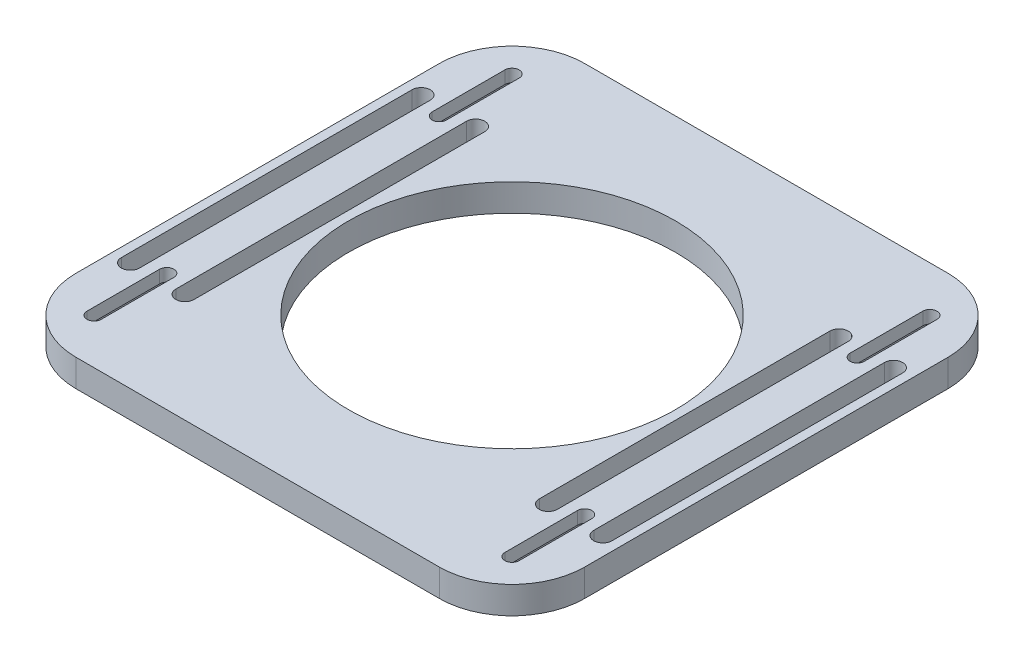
SolidWorks part; units mm, degrees
ref_plane "Front Plane" through (0, 0, 0) normal (0, 0, 1) x (1, 0, 0)
ref_plane "Top Plane" through (0, 0, 0) normal (0, 1, 0) x (1, 0, 0)
ref_plane "Right Plane" through (0, 0, 0) normal (1, 0, 0) x (0, 0, -1)
sketch "Sketch1" plane through (0, 0, 0) normal (0, 1, 0) x (1, 0, 0)
  line L1 (-88.9, 88.9) -> (88.9, 88.9)
  line L2 (-88.9, 88.9) -> (-88.9, -88.9)
  line L3 (-88.9, -88.9) -> (88.9, -88.9)
  line L4 (88.9, 88.9) -> (88.9, -88.9)
  line L5 (-88.9, 88.9) -> (88.9, -88.9) construction
  line L6 (-88.9, -88.9) -> (88.9, 88.9) construction
  circle A0 centre (0, 0) radius 57.15
  point P0 (0, 0)
  dimension "D3" = 114.3
  dimension "D1" = 177.8
  dimension "D2" = 177.8
extrude "Boss-Extrude1" add sketch "Sketch1" along normal blind 9.525
fillet "Fillet1" radius 25.4 4 edges at (-88.9, 4.7625, -88.9) (88.9, 4.7625, -88.9) (88.9, 4.7625, 88.9) (-88.9, 4.7625, 88.9)
sketch "Sketch2" plane through (0, 9.525, 0) normal (0, 1, 0) x (1, 0, 0)
  line L0 (0, -107.4058) -> (0, 115.9567) construction
  line L1 (-110.9939, 0) -> (128.1398, 0) construction
  line L2 (73.025, -103.7714) -> (73.025, 98.4828) construction
  line L3 (63.5, -103.7714) -> (63.5, 98.4828) construction
  line L4 (82.55, 98.4828) -> (82.55, -103.7714) construction
  line L5 (82.55, 50.8) -> (82.55, -50.8) construction
  line L6 (85.725, 50.8) -> (85.725, -50.8)
  line L7 (79.375, 50.8) -> (79.375, -50.8)
  line L8 (63.5, 50.8) -> (63.5, -50.8) construction
  line L9 (60.325, 50.8) -> (60.325, -50.8)
  line L10 (66.675, 50.8) -> (66.675, -50.8)
  line L11 (-82.55, 50.8) -> (-82.55, -50.8) construction
  line L12 (-85.725, 50.8) -> (-85.725, -50.8)
  line L13 (-79.375, 50.8) -> (-79.375, -50.8)
  line L14 (-63.5, 50.8) -> (-63.5, -50.8) construction
  line L15 (-60.325, 50.8) -> (-60.325, -50.8)
  line L16 (-66.675, 50.8) -> (-66.675, -50.8)
  arc A0 (85.725, 50.8) -> (79.375, 50.8) centre (82.55, 50.8) ccw
  arc A1 (79.375, -50.8) -> (85.725, -50.8) centre (82.55, -50.8) ccw
  arc A2 (60.325, 50.8) -> (66.675, 50.8) centre (63.5, 50.8) cw
  arc A3 (66.675, -50.8) -> (60.325, -50.8) centre (63.5, -50.8) cw
  arc A4 (-85.725, 50.8) -> (-79.375, 50.8) centre (-82.55, 50.8) cw
  arc A5 (-79.375, -50.8) -> (-85.725, -50.8) centre (-82.55, -50.8) cw
  arc A6 (-60.325, 50.8) -> (-66.675, 50.8) centre (-63.5, 50.8) ccw
  arc A7 (-66.675, -50.8) -> (-60.325, -50.8) centre (-63.5, -50.8) ccw
  point P13 (82.55, 0)
  point P20 (63.5, 0)
  point P27 (-82.55, 0)
  point P34 (-63.5, 0)
  dimension "D4" = 101.6
  dimension "D1" = 9.525
  dimension "D2" = 9.525
  dimension "D3" = 73.025
extrude "Cut-Extrude1" cut sketch "Sketch2" against normal blind 6.35
sketch "Sketch3" plane through (0, 9.525, 0) normal (0, 1, 0) x (1, 0, 0)
  line L0 (73.025, -112.4398) -> (73.025, 109.7359) construction
  line L1 (123.9264, 0) -> (-104.5674, 0) construction
  line L2 (73.025, -73.025) -> (73.025, -47.625) construction
  line L3 (70.5358, -73.025) -> (70.5358, -47.625)
  line L4 (75.5142, -73.025) -> (75.5142, -47.625)
  line L5 (73.025, 73.025) -> (73.025, 47.625) construction
  line L6 (70.5358, 73.025) -> (70.5358, 47.625)
  line L7 (75.5142, 73.025) -> (75.5142, 47.625)
  line L8 (0, 0) -> (0, 95.2721) construction
  line L9 (-73.025, -73.025) -> (-73.025, -47.625) construction
  line L10 (-70.5358, -73.025) -> (-70.5358, -47.625)
  line L11 (-75.5142, -73.025) -> (-75.5142, -47.625)
  line L12 (-73.025, 73.025) -> (-73.025, 47.625) construction
  line L13 (-70.5358, 73.025) -> (-70.5358, 47.625)
  line L14 (-75.5142, 73.025) -> (-75.5142, 47.625)
  circle A0 centre (0, 0) radius 57.15 construction
  arc A2 (70.5358, -73.025) -> (75.5142, -73.025) centre (73.025, -73.025) ccw
  arc A3 (75.5142, -47.625) -> (70.5358, -47.625) centre (73.025, -47.625) ccw
  arc A4 (70.5358, 73.025) -> (75.5142, 73.025) centre (73.025, 73.025) cw
  arc A5 (75.5142, 47.625) -> (70.5358, 47.625) centre (73.025, 47.625) cw
  arc A6 (-70.5358, -73.025) -> (-75.5142, -73.025) centre (-73.025, -73.025) cw
  arc A7 (-75.5142, -47.625) -> (-70.5358, -47.625) centre (-73.025, -47.625) cw
  arc A8 (-70.5358, 73.025) -> (-75.5142, 73.025) centre (-73.025, 73.025) ccw
  arc A9 (-75.5142, 47.625) -> (-70.5358, 47.625) centre (-73.025, 47.625) ccw
  point P9 (73.025, -60.325)
  point P16 (73.025, 60.325)
  point P26 (-73.025, -60.325)
  point P33 (-73.025, 60.325)
  dimension "D2" = 60.325
  dimension "D3" = 25.4
  dimension "D1" = 73.025
extrude "Cut-Extrude2" cut sketch "Sketch3" against normal through all
sketch "Sketch4" plane through (0, 0, 0) normal (0, -1, 0) x (1, 0, 0)
  line L0 (73.025, 73.025) -> (73.025, 47.625) construction
  line L1 (77.47, 73.025) -> (77.47, 47.625)
  line L2 (68.58, 73.025) -> (68.58, 47.625)
  line L3 (0, 0) -> (0, 117.4438) construction
  line L4 (0, 0) -> (99.4656, 0) construction
  line L5 (-73.025, 73.025) -> (-73.025, 47.625) construction
  line L6 (-77.47, 73.025) -> (-77.47, 47.625)
  line L7 (-68.58, 73.025) -> (-68.58, 47.625)
  line L8 (73.025, -73.025) -> (73.025, -47.625) construction
  line L9 (77.47, -73.025) -> (77.47, -47.625)
  line L10 (68.58, -73.025) -> (68.58, -47.625)
  line L11 (-73.025, -73.025) -> (-73.025, -47.625) construction
  line L12 (-77.47, -73.025) -> (-77.47, -47.625)
  line L13 (-68.58, -73.025) -> (-68.58, -47.625)
  arc A0 (77.47, 73.025) -> (68.58, 73.025) centre (73.025, 73.025) ccw
  arc A1 (68.58, 47.625) -> (77.47, 47.625) centre (73.025, 47.625) ccw
  arc A2 (-77.47, 73.025) -> (-68.58, 73.025) centre (-73.025, 73.025) cw
  arc A3 (-68.58, 47.625) -> (-77.47, 47.625) centre (-73.025, 47.625) cw
  arc A4 (77.47, -73.025) -> (68.58, -73.025) centre (73.025, -73.025) cw
  arc A5 (68.58, -47.625) -> (77.47, -47.625) centre (73.025, -47.625) cw
  arc A6 (-77.47, -73.025) -> (-68.58, -73.025) centre (-73.025, -73.025) ccw
  arc A7 (-68.58, -47.625) -> (-77.47, -47.625) centre (-73.025, -47.625) ccw
  point P4 (73.025, 60.325)
  point P15 (-73.025, 60.325)
  point P22 (73.025, -60.325)
  point P29 (-73.025, -60.325)
extrude "Cut-Extrude3" cut sketch "Sketch4" against normal blind 5.08
